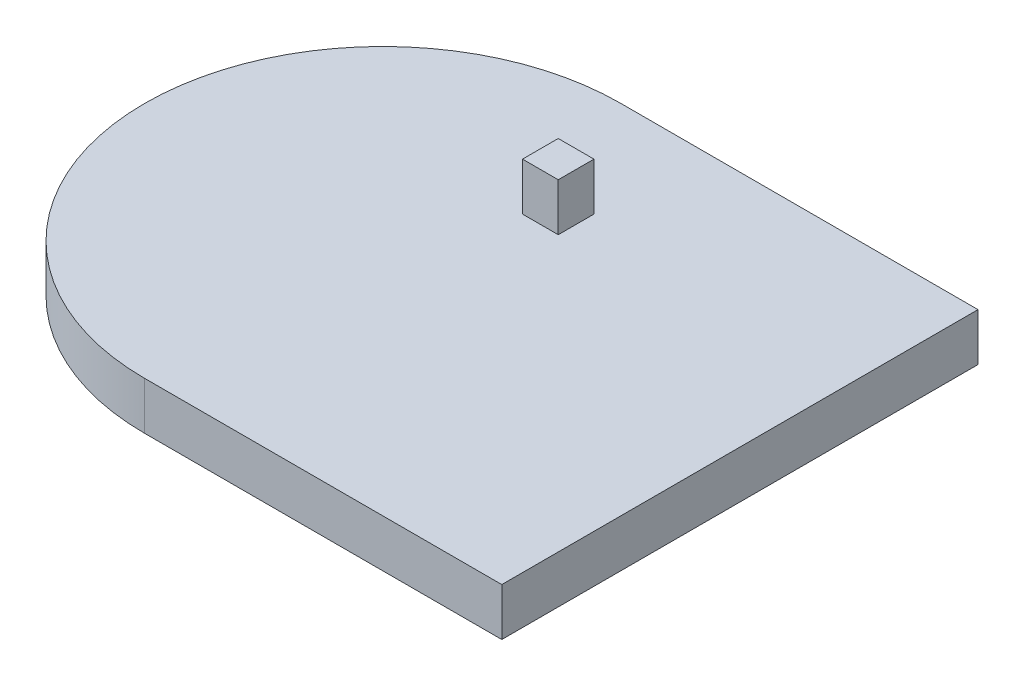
SolidWorks part; units mm, degrees
ref_plane "Front" through (0, 0, 0) normal (0, 0, 1) x (1, 0, 0)
ref_plane "Top" through (0, 0, 0) normal (0, 1, 0) x (1, 0, 0)
ref_plane "Right" through (0, 0, 0) normal (1, 0, 0) x (0, 0, -1)
sketch "Sketch1" plane through (0, 0, 0) normal (0, 1, 0) x (1, 0, 0)
  line L0 (75, -100) -> (-75, 100) construction
  line L1 (-75, 100) -> (75, 100)
  line L3 (-75, -100) -> (75, -100)
  line L4 (75, 100) -> (75, -100)
  arc A0 (-75, 100) -> (-75, -100) centre (-75, 0) ccw
  dimension "D1" = 150
  dimension "D2" = 200
extrude "Extrude1" add sketch "Sketch1" along normal blind 20
sketch "Sketch2" plane through (0, 20, 0) normal (0, 1, 0) x (-1, 0, 0)
  ellipse E0 centre (47.8826, 0) end of major axis (152.5978, 0) minor radius 54.09 construction
sketch "Sketch3" plane through (0, 20, 0) normal (0, 1, 0) x (-1, 0, 0)
  line L1 (55.3826, -54.09) -> (40.3826, -54.09)
  line L2 (55.3826, -54.09) -> (55.3826, -39.09)
  line L3 (55.3826, -39.09) -> (40.3826, -39.09)
  line L4 (40.3826, -54.09) -> (40.3826, -39.09)
  dimension "D1" = 15
  dimension "D2" = 15
extrude "Extrude2" add sketch "Sketch3" along normal blind 20
